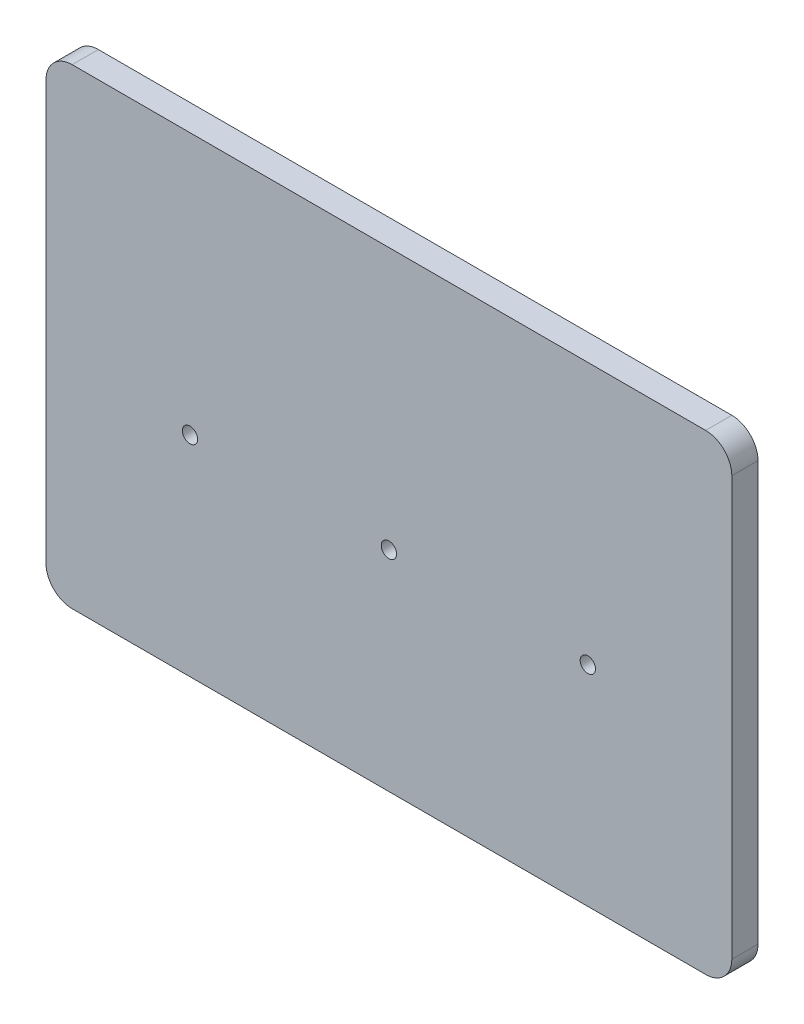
SolidWorks part; units mm, degrees
ref_plane "Plan de face" through (0, 0, 0) normal (0, 0, 1) x (1, 0, 0)
ref_plane "Plan de dessus" through (0, 0, 0) normal (0, 1, 0) x (1, 0, 0)
ref_plane "Plan de droite" through (0, 0, 0) normal (1, 0, 0) x (0, 0, -1)
sketch "Esquisse1" plane through (0, 0, 0) normal (0, 0, 1) x (1, 0, 0)
  line L0 (-153.7176, -80) -> (145.7174, -80) construction
  line L1 (-153.7176, 100) -> (159.432, 100) construction
  line L2 (-131, 110.004) -> (-131, -100.8608) construction
  line L3 (131, 131) -> (131, -104.2895) construction
  line L4 (-142.8602, 0) -> (140.2887, 0) construction
  line L5 (0, 62.8594) -> (0, -43.7159) construction
  line L6 (-76, 26.8581) -> (-76, -22.5723) construction
  line L7 (76, 26.8581) -> (76, -26.5724) construction
  line L9 (-121, 100) -> (121, 100)
  line L10 (-131, 90) -> (-131, -70)
  line L11 (-121, -80) -> (121, -80)
  line L12 (131, 90) -> (131, -70)
  arc A0 (-121, 100) -> (-131, 90) centre (-121, 90) ccw
  arc A1 (121, 100) -> (131, 90) centre (121, 90) cw
  arc A2 (121, -80) -> (131, -70) centre (121, -70) ccw
  arc A3 (-131, -70) -> (-121, -80) centre (-121, -70) ccw
  circle A4 centre (-76, 0) radius 2.93
  circle A5 centre (0, 0) radius 2.93
  circle A6 centre (76, 0) radius 2.93
  point P23 (-131, 100)
  point P28 (131, -80)
  dimension "D1" = 10
extrude "Extrusion1" add sketch "Esquisse1" along normal blind 10
